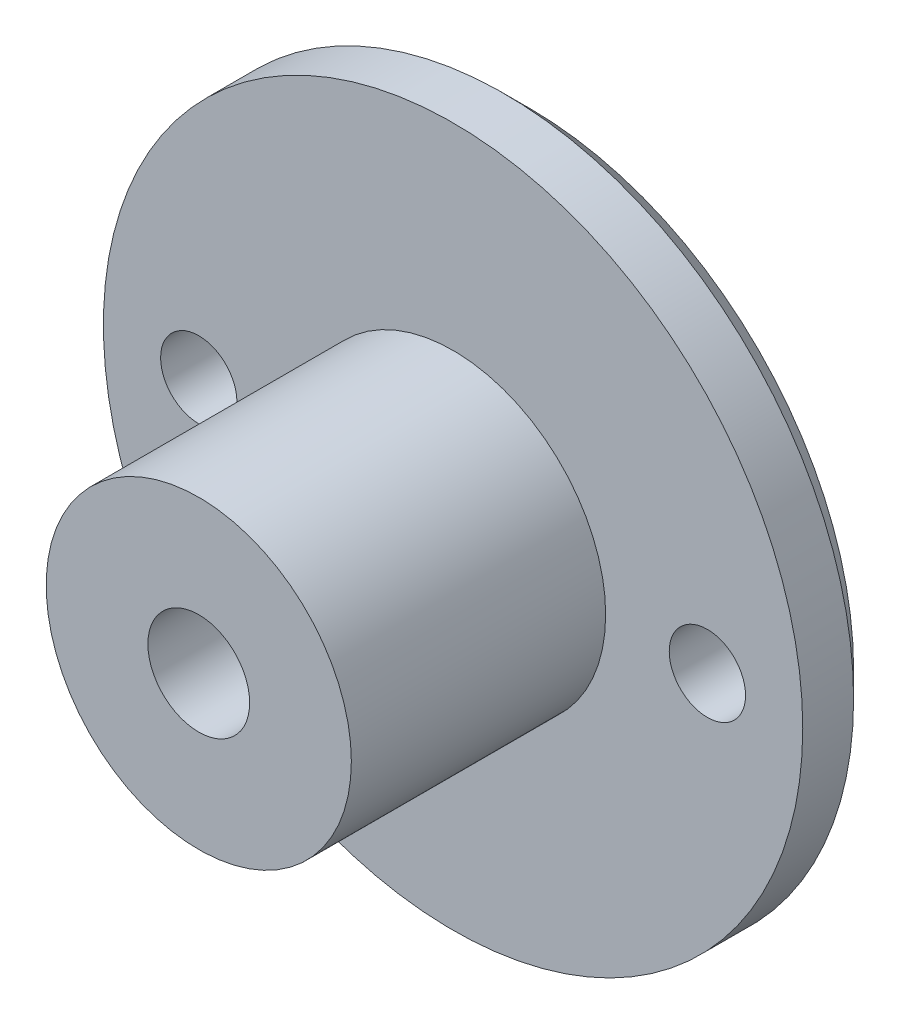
SolidWorks part; units mm, degrees
ref_plane "Front" through (0, 0, 0) normal (0, 0, 1) x (1, 0, 0)
ref_plane "Top" through (0, 0, 0) normal (0, 1, 0) x (1, 0, 0)
ref_plane "Right" through (0, 0, 0) normal (1, 0, 0) x (0, 0, -1)
sketch "Esquisse1" plane through (0, 0, 0) normal (0, 0, 1) x (1, 0, 0)
  circle A0 centre (0, 0) radius 13.75
  dimension "D1" = 27.5
extrude "Boss.-Extru.1" add sketch "Esquisse1" along normal blind 3
sketch "Esquisse2" plane through (0, 0, 3) normal (0, 0, 1) x (1, 0, 0)
  circle A0 centre (0, 0) radius 6
  dimension "D1" = 12
extrude "Boss.-Extru.2" add sketch "Esquisse2" along normal blind 10
chamfer "Chanfrein1" distance 1 angle 45 1 edges at (13.75, 0, 0)
hole_wizard "Diamètre du perçage Ø0.15 (0.15)1" positions "Esquisse4" profile "Esquisse3" hole size "Ø0.15" standard "Ansi Metric"
sketch "Esquisse4" plane through (0, 0, 0) normal (0, 0, -1) x (-1, 0, 0)
  point P0 (0, 0)
sketch "Esquisse3" plane through (0, 0, 0) normal (1, 0, 0) x (0, 1, 0)
  line L0 (0, 0) -> (0, 13)
  line L1 (0, 13) -> (2, 13)
  line L2 (2, 13) -> (2, 0)
  line L5 (2, 0) -> (0, 0)
  line L11 (0, -6.35) -> (0, 107.95) construction
  dimension "Diamètre du perçage jusqu'au prochain" = 4
  dimension "Profondeur du perçage jusqu'au prochain" = 13
hole_wizard "Diamètre du perçage Ø0.15 (0.15)2" positions "Esquisse7" profile "Esquisse6" hole size "Ø0.15" standard "Ansi Metric"
sketch "Esquisse7" plane through (0, 0, 0) normal (0, 0, -1) x (-1, 0, 0)
  point P0 (-10, 0)
  dimension "D1" = 10
sketch "Esquisse6" plane through (10, 0, 0) normal (1, 0, 0) x (0, 1, 0)
  line L0 (0, 0) -> (0, 3.001)
  line L1 (0, 3.001) -> (1.5, 3.001)
  line L2 (1.5, 3.001) -> (1.5, 0)
  line L5 (1.5, 0) -> (0, 0)
  line L11 (0, -6.35) -> (0, 107.95) construction
  dimension "Diamètre du perçage jusqu'au prochain" = 3
  dimension "Profondeur du perçage jusqu'au prochain" = 3.001
pattern_circular "Répétition circulaire1" count 2 over 360 about axis through (0, 0, 0) along (0, 0, 1) of "Diamètre du perçage Ø0.15 (0.15)2"
